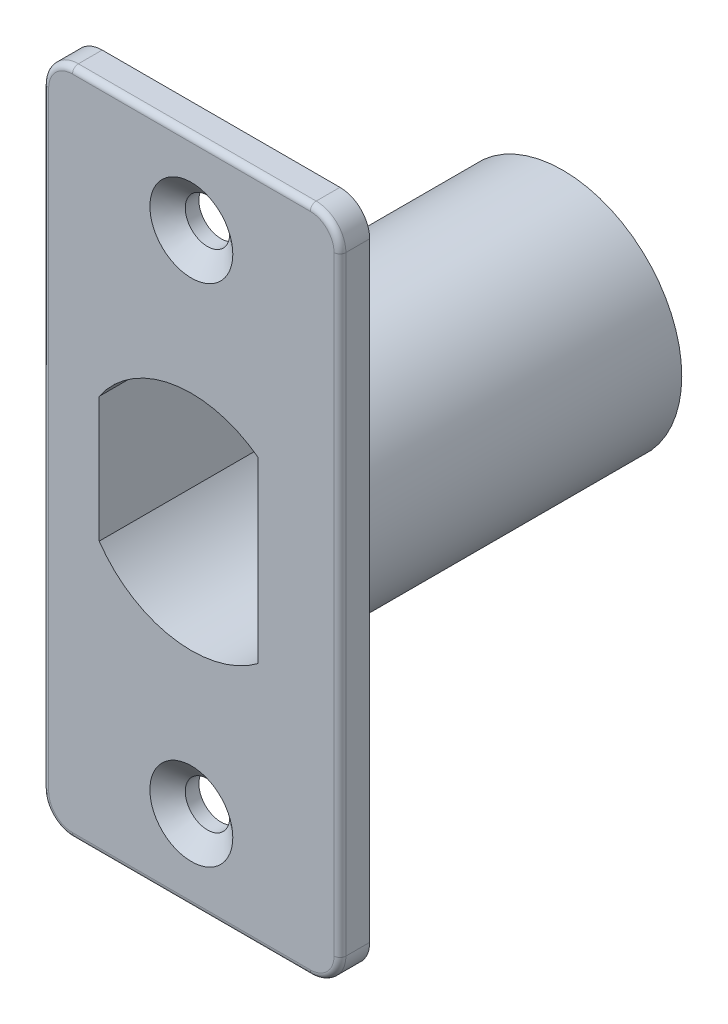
SolidWorks part; units mm, degrees
ref_plane "Front Plane" through (0, 0, 0) normal (0, 0, 1) x (1, 0, 0)
ref_plane "Top Plane" through (0, 0, 0) normal (0, 1, 0) x (1, 0, 0)
ref_plane "Right Plane" through (0, 0, 0) normal (1, 0, 0) x (0, 0, -1)
sketch "Sketch1" plane through (0, 0, 0) normal (0, 0, 1) x (1, 0, 0)
  line L1 (-12.7, -28.575) -> (12.7, -28.575)
  line L2 (-12.7, -28.575) -> (-12.7, 28.575)
  line L3 (-12.7, 28.575) -> (12.7, 28.575)
  line L4 (12.7, -28.575) -> (12.7, 28.575)
  line L5 (-12.7, -28.575) -> (12.7, 28.575) construction
  line L6 (-12.7, 28.575) -> (12.7, -28.575) construction
  point P0 (0, 0)
  dimension "D1" = 25.4
  dimension "D2" = 57.15
extrude "Boss-Extrude1" add sketch "Sketch1" along normal blind 2.54
sketch "Sketch2" plane through (0, 0, 2.54) normal (0, 0, 1) x (1, 0, 0)
  circle A0 centre (0, 0) radius 10.16
  dimension "D1" = 20.32
extrude "Boss-Extrude2" add sketch "Sketch2" against normal blind 31.75
sketch "Sketch3" plane through (0, 0, 2.54) normal (0, 0, 1) x (1, 0, 0)
  line L0 (-7.8742, 5.3594) -> (-7.8742, -5.3594)
  line L1 (5.715, 7.62) -> (5.715, -7.62)
  arc A0 (5.715, 7.62) -> (-7.8742, 5.3594) centre (0, 0) ccw
  arc A1 (-7.8742, -5.3594) -> (5.715, -7.62) centre (0, 0) ccw
  dimension "D1" = 9.525
  dimension "D2" = 10.7188
  dimension "D3" = 15.24
extrude "Cut-Extrude1" cut sketch "Sketch3" against normal blind 31.75
hole_wizard "CSK for #6 Flat Head Machine Screw (100)1" positions "Sketch5" profile "Sketch4" countersink size "#6" standard "Ansi Inch"
sketch "Sketch5" plane through (0, 0, 2.54) normal (0, 0, 1) x (1, 0, 0)
  line L0 (0, 0) -> (29.4513, 0) construction
  line L2 (12.7, 28.575) -> (-12.7, 28.575) construction
  point P0 (0, 21.59)
  point P1 (0, -21.59)
  dimension "D1" = 6.985
sketch "Sketch4" plane through (0, 21.59, 2.54) normal (1, 0, 0) x (0, -1, 0)
  line L0 (0, 0) -> (0, 31.75)
  line L1 (0, 31.75) -> (1.8986, 31.75)
  line L2 (1.8986, 31.75) -> (1.8986, 1.38)
  line L3 (1.8986, 1.38) -> (3.5433, 0)
  line L5 (3.5433, 0) -> (0, 0)
  line L6 (-1.8986, 1.38) -> (-3.5433, 0) construction
  line L11 (0, -6.35) -> (0, 107.95) construction
  dimension "Thru Hole Dia." = 3.7973
  dimension "Thru Hole Depth" = 31.75
  dimension "Near C'Sink Dia." = 7.0866
  dimension "Near C'Sink Angle" = 100
sketch "Sketch6" plane through (0, 0, -29.21) normal (0, 0, -1) x (-1, 0, 0)
  line L0 (-5.715, -7.62) -> (-5.715, 7.62) construction
  line L1 (-5.715, -7.62) -> (-5.715, 7.62)
  line L2 (0, 9.525) -> (0, -9.525)
  arc A0 (7.8742, 5.3594) -> (-5.715, 7.62) centre (0, 0) ccw construction
  arc A1 (-5.715, -7.62) -> (7.8742, -5.3594) centre (0, 0) ccw construction
  arc A2 (0, 9.525) -> (-5.715, 7.62) centre (0, 0) ccw
  arc A3 (-5.715, -7.62) -> (0, -9.525) centre (0, 0) ccw
extrude "Boss-Extrude3" add sketch "Sketch6" against normal blind 1.27
fillet "Fillet1" radius 2.54 4 edges at (12.7, -28.575, 1.27) (-12.7, -28.575, 1.27) (-12.7, 28.575, 1.27) (12.7, 28.575, 1.27)
fillet "Fillet2" radius 0.508 8 edges at (-11.9561, 27.8311, 2.54) (0, 28.575, 2.54) (11.9561, 27.8311, 2.54) (12.7, 0, 2.54) (11.9561, -27.8311, 2.54) (0, -28.575, 2.54) (-11.9561, -27.8311, 2.54) (-12.7, 0, 2.54)
